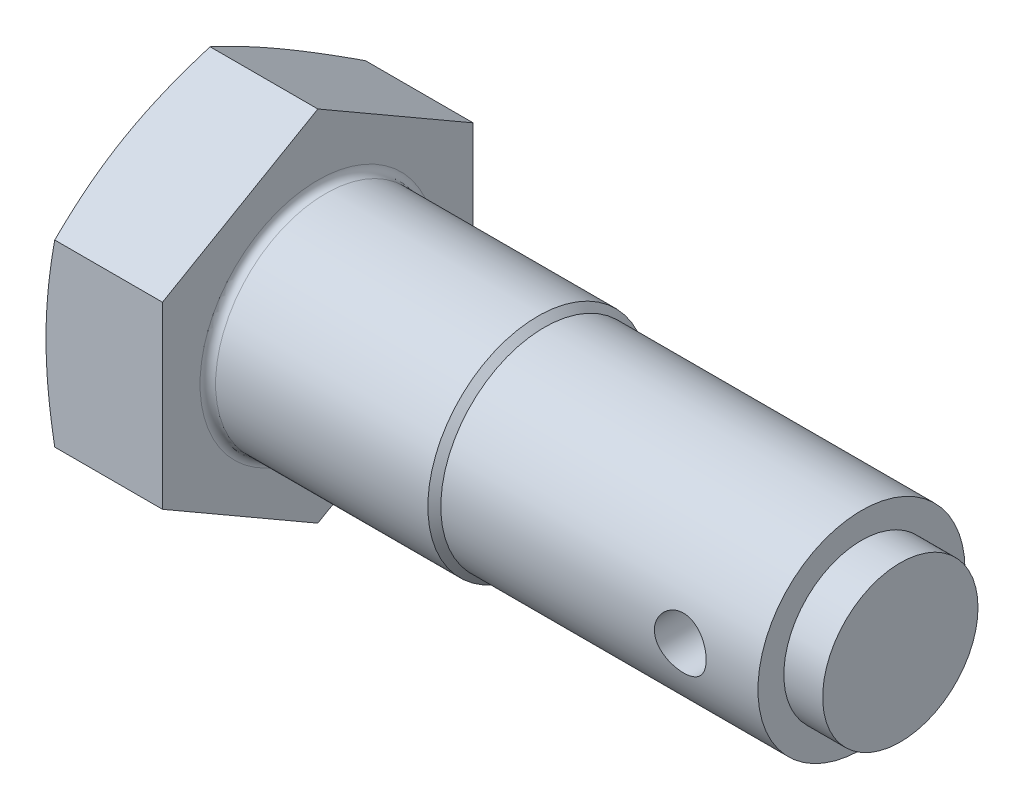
SolidWorks part; units mm, degrees
ref_plane "Front" through (0, 0, 0) normal (0, 0, 1) x (1, 0, 0)
ref_plane "Top" through (0, 0, 0) normal (0, 1, 0) x (1, 0, 0)
ref_plane "Right" through (0, 0, 0) normal (1, 0, 0) x (0, 0, -1)
sketch "Sketch1" plane through (0, 0, 0) normal (1, 0, 0) x (0, 0, -1)
  line L1 (0, -13.8564) -> (12, -6.9282)
  line L2 (12, -6.9282) -> (12, 6.9282)
  line L3 (12, 6.9282) -> (0, 13.8564)
  line L4 (0, 13.8564) -> (-12, 6.9282)
  line L5 (-12, 6.9282) -> (-12, -6.9282)
  line L6 (-12, -6.9282) -> (0, -13.8564)
  circle A0 centre (0, 0) radius 12 construction
  dimension "s" = 24
extrude "BaseHead" add sketch "Sketch1" along normal blind 9
sketch "Sketch2" plane through (9, 0, 0) normal (1, 0, 0) x (0, 0, -1)
  circle A0 centre (0, 0) radius 8.5
  dimension "ds" = 17
extrude "Basebody1" add sketch "Sketch2" along normal blind 17
sketch "Sketch4" plane through (26, 0, 0) normal (1, 0, 0) x (0, 0, -1)
  circle A0 centre (0, 0) radius 8
  dimension "d" = 16
extrude "Basebody2" add sketch "Sketch4" along normal offset from surface (28 mm away) 45
sketch "Sketch5" plane through (54, 0, 0) normal (1, 0, 0) x (0, 0, -1)
  circle A0 centre (0, 0) radius 6
  dimension "dp" = 12
extrude "Cut-Extrude1" cut sketch "Sketch5" against normal blind 3 flip side to cut
sketch "Sketch6" plane through (0, 0, 0) normal (0, 0, 1) x (1, 0, 0)
  line L0 (0, 13.8564) -> (0.6757, 13.8564)
  line L1 (0.6757, 13.8564) -> (0, 12)
  line L3 (0, 12) -> (0, 13.8564)
  line L4 (-1.5773, 0) -> (3.1205, 0) construction
  line L6 (9, 13.8564) -> (0, 13.8564) construction
  dimension "D1" = 20
  dimension "D2" = 24
revolve "HeadChamfer" cut sketch "Sketch6" angle 360 about L4
fillet "HeadFillet" radius 0.6 1 edges at (9, 0, -8.5)
chamfer "Chamfer1" distance 0.5 angle 45 1 edges at (26, 0, -8)
sketch "Sketch7" plane through (0, 0, 0) normal (0, 0, 1) x (1, 0, 0)
  line L1 (9, 13.8564) -> (9, 6.9282) construction
  line L4 (51, 0) -> (26.5, 0) construction
  circle A0 centre (45, 0) radius 2
  dimension "d1" = 4
  dimension "lh" = 36
extrude "Hole" cut sketch "Sketch7" against normal through all and the other way through all
equation "\"D1@Chamfer1\" =  ( \"ds@Sketch2\" - \"d@Sketch4\" )  / 2"
equation "\"D2@Sketch6\" = \"s@Sketch1\""
